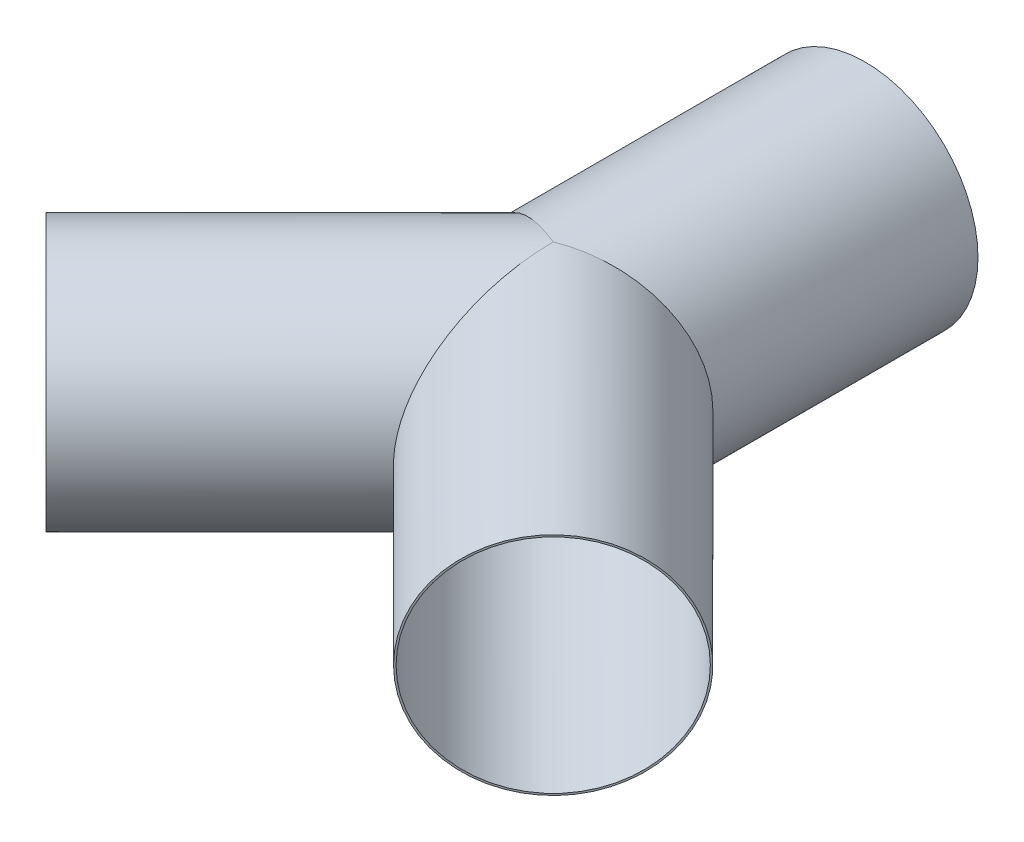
SolidWorks part; units mm, degrees
ref_plane "Y" through (0, 0, 0) normal (0, 0, 1) x (1, 0, 0)
ref_plane "Z" through (0, 0, 0) normal (0, 1, 0) x (1, 0, 0)
ref_plane "X" through (0, 0, 0) normal (1, 0, 0) x (0, 0, -1)
sketch "Hauptskizze" plane through (0, 0, 0) normal (0, 1, 0) x (1, 0, 0)
  line L0 (707.4443, -707.4443) -> (0, 0) construction
  line L1 (0, 0) -> (-707.4443, -707.4443) construction
  line L10 (0, -445.4773) -> (0, 1202.1842) construction
  line L11 (-930.1829, -484.7056) -> (-484.7056, -930.1829)
  line L12 (484.7056, -930.1829) -> (930.1829, -484.7056)
  line L13 (315, 870) -> (-315, 870)
  line L14 (-315, 130.4773) -> (-930.1829, -484.7056)
  line L15 (-484.7056, -930.1829) -> (0, -445.4773)
  line L16 (0, -445.4773) -> (484.7056, -930.1829)
  line L17 (930.1829, -484.7056) -> (315, 130.4773)
  line L18 (315, 130.4773) -> (315, 870)
  line L19 (-315, 870) -> (-315, 130.4773)
  dimension "D1" = 630
  dimension "D2" = 870
  dimension "D3" = 45
  dimension "D4" = 870
  dimension "D5" = 630
ref_plane "Ebene3" through (0, 0, 0) normal (-0.7071, 0, 0.7071) x (0.7071, 0, 0.7071)
sketch "Skizze1" plane through (0, 0, 0) normal (0, 0, 1) x (1, 0, 0)
  circle A0 centre (0, 0) radius 315
  dimension "D1" = 630
extrude "Linear austragen1" add sketch "Skizze1" against normal up to vertex
sketch "Skizze6" plane through (0, 0, 0) normal (-0.7071, 0, 0.7071) x (0.7071, 0, 0.7071)
  circle A0 centre (0, 0) radius 315
  ellipse E0 centre (0, 0) end of major axis (0, -315) minor radius 222.7386 construction
extrude "Linear austragen2" add sketch "Skizze6" along normal up to vertex
mirror "Spiegeln1" about plane through (0, 0, 0) normal (1, 0, 0) of "Linear austragen2"
shell "Wandung1" thickness 5
sketch "Skizze9" [suppressed] plane through (0, 0, 0) normal (0, 1, 0) x (1, 0, 0)
  line L0 (0, -445.4773) -> (0, 1202.1842) construction
  line L1 (0, -887.3205) -> (0, 0)
  line L2 (0, 0) -> (315, 130.4773) construction
  line L3 (0, 0) -> (612.358, 253.647) construction
  line L4 (-315, 130.4773) -> (0, 0) construction
  line L5 (-645.4758, 267.3648) -> (0, 0)
surface "Oberfläche-Linear austragen1" [suppressed] sketch "Skizze9" parameters "D1"=700
mirror "Spiegeln3" [suppressed] about plane through (0, 0, 0) normal (1, 0, 0)
split "Abspalten1" [suppressed] parameters "Dicke"=2
